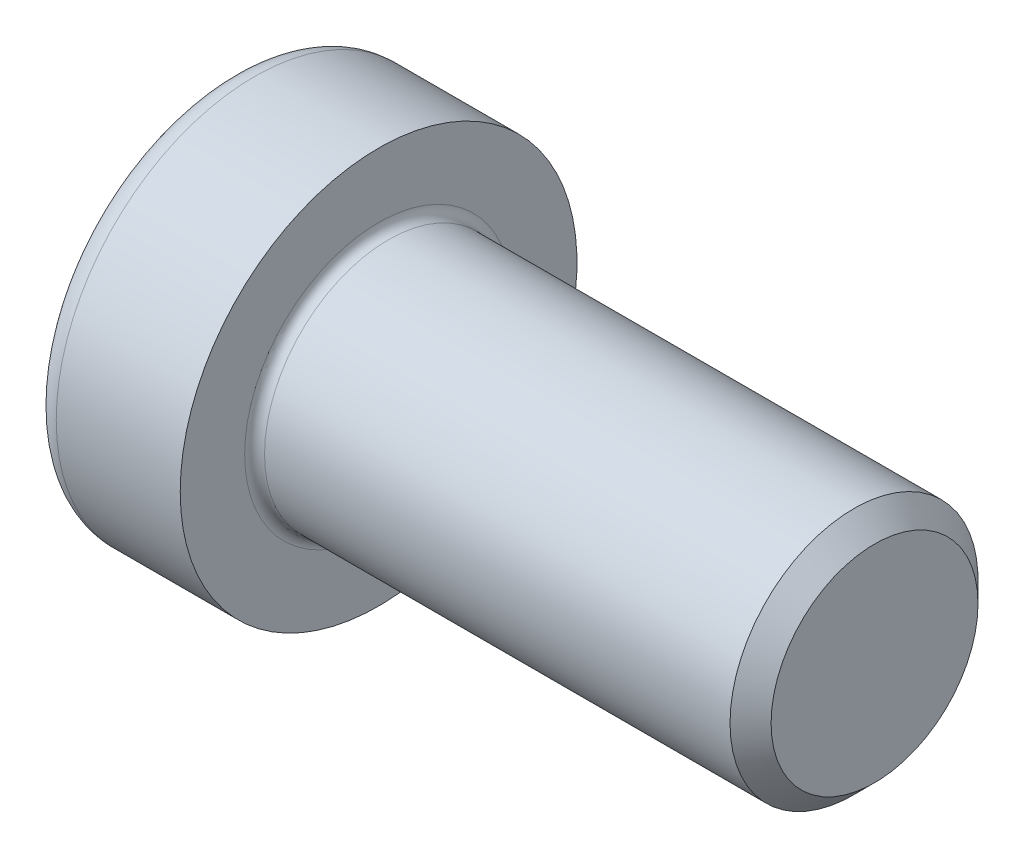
SolidWorks part; units mm, degrees
revolve "Base-Revolve" add sketch "BodySke" angle 360 about L6
sketch "BodySke" plane through (0, 0, 0) normal (0, 0, 1) x (1, 0, 0)
  line L0 (0, 0) -> (0, 8)
  line L1 (0, 8) -> (6, 8)
  line L2 (6, 8) -> (6, 5)
  line L3 (6, 5) -> (25.172, 5)
  line L4 (26, 4.172) -> (26, 0)
  line L5 (26, 0) -> (0, 0)
  line L6 (-31.75, 0) -> (127, 0) construction
  line L8 (26, 4.172) -> (25.172, 5)
  line L10 (26, -4.172) -> (25.172, -5) construction
  line L11 (7.5, 4.525) -> (7.5, -1.825) construction
  line L12 (5.5, 4.525) -> (5.5, -1.825) construction
  line L13 (-34, 4.525) -> (-34, -1.825) construction
  dimension "Diameter" = 10
  dimension "Head_ht" = 6
  dimension "Length" = 20
  dimension "Body_ch_ang" = 45
  dimension "Head_dia" = 16
  dimension "Minor_dia" = 8.344
  dimension "Advance" = 1.5
  dimension "Thread_nom" = 20.5
  dimension "Thread_length" = 60
fillet "Fillet2" radius 1 1 edges at (0, 0, 8)
ref_plane "Plane1" through (0, 0, 0) normal (0, 0, 1) x (1, 0, 0)
ref_plane "Plane2" through (0, 0, 0) normal (0, 1, 0) x (1, 0, 0)
ref_plane "Plane3" through (0, 0, 0) normal (1, 0, 0) x (0, 0, -1)
fillet "Fillet1" radius 0.4 1 edges at (6, 0, 5)
sketch "Sketch2" plane through (0, 0, 0) normal (0, 0, 1) x (1, 0, 0)
  line L0 (0, 3.5) -> (4.5, 3.5)
  line L1 (4.5, 3.5) -> (6.5207, 0)
  line L2 (-31.75, 0) -> (127, 0) construction
  line L3 (6.5207, 0) -> (0, 0)
  line L4 (0, 0) -> (0, 3.5)
  line L6 (0, 0) -> (47.625, 0) construction
revolve "Hex-PreBroach" cut sketch "Sketch2" angle 360 about L6
sketch "Sketch3" plane through (0, 0, 0) normal (-1, 0, 0) x (0, 0.5, 0.866)
  line L0 (2.0207, 3.5) -> (-2.0207, 3.5)
  line L1 (-2.0207, 3.5) -> (-4.0415, 0)
  line L2 (2.0207, 3.5) -> (4.0415, 0)
  line L3 (2.0207, -3.5) -> (4.0415, 0)
  line L4 (2.0207, -3.5) -> (-2.0207, -3.5)
  line L5 (-2.0207, -3.5) -> (-4.0415, 0)
extrude "Hex" cut sketch "Sketch3" against normal blind 4.5
sketch "ThdSchSke" plane through (0, 0, 0) normal (0, 0, 1) x (1, 0, 0)
  line L0 (10.5, -4.172) -> (9.9202, -5)
  line L1 (10.5, -4.172) -> (11.0798, -5)
  line L2 (11.0798, -5) -> (11.0798, -6.25)
  line L3 (-3.175, 0) -> (5.1513, 0) construction
  line L4 (0, 7) -> (0, -7) construction
  line L5 (11.0798, -6.25) -> (9.9202, -6.25)
  line L6 (9.9202, -6.25) -> (9.9202, -5)
revolve "ThreadSchematic" [suppressed] cut sketch "ThdSchSke" angle 360 about L3
pattern_linear "ThdSchPat" [suppressed]
thread "Filetage1" pitch 1.5 start angle 0, offset 3, length 18, pitch 1.5, diameter 10
ref_plane "Plan1" through (28.172, 0, 5) normal (0, -1, 0) x (0, 0, 1)
sketch "Profil de filetage1" plane through (28.172, 0, 5) normal (0, -1, 0) x (0, 0, 1)
  line L0 (0, 0) -> (0, 1.5) construction
  line L11 (0, 0) -> (0, 1.3125)
  line L12 (0, 1.3125) -> (-0.8119, 0.8437)
  line L13 (-0.8119, 0.8437) -> (-0.8119, 0.4687)
  line L15 (-0.8119, 0.4687) -> (0, 0)
  line L17 (-0.8119, 0.6562) -> (0, 0.6562) construction
  point P2 (0, 0)
  dimension "Pitch" = 1.5
  dimension "Profile_Angle" = 60
  dimension "Profile_Land" = 0.375
  dimension "Profile_Height" = 0.8119
equation "\"D2@Sketch3\" = \"Hex_size@Sketch3\" / 2"
equation "\"D1@Sketch3\" = \"Hex_size@Sketch3\" / 2"
equation "\"D1@Sketch2\" = \"Hex_size@Sketch3\" / 2"
equation "\"Depth@Sketch2\" =  \"Key_eng@Hex\""
equation "\"Thread_minor@ThdSchSke\" = \"Minor_dia@BodySke\""
equation "\"Diameter@ThdSchSke\" = \"Diameter@BodySke\""
equation "\"Overcut@ThdSchSke\" = \"Diameter@BodySke\" * 1.25"
